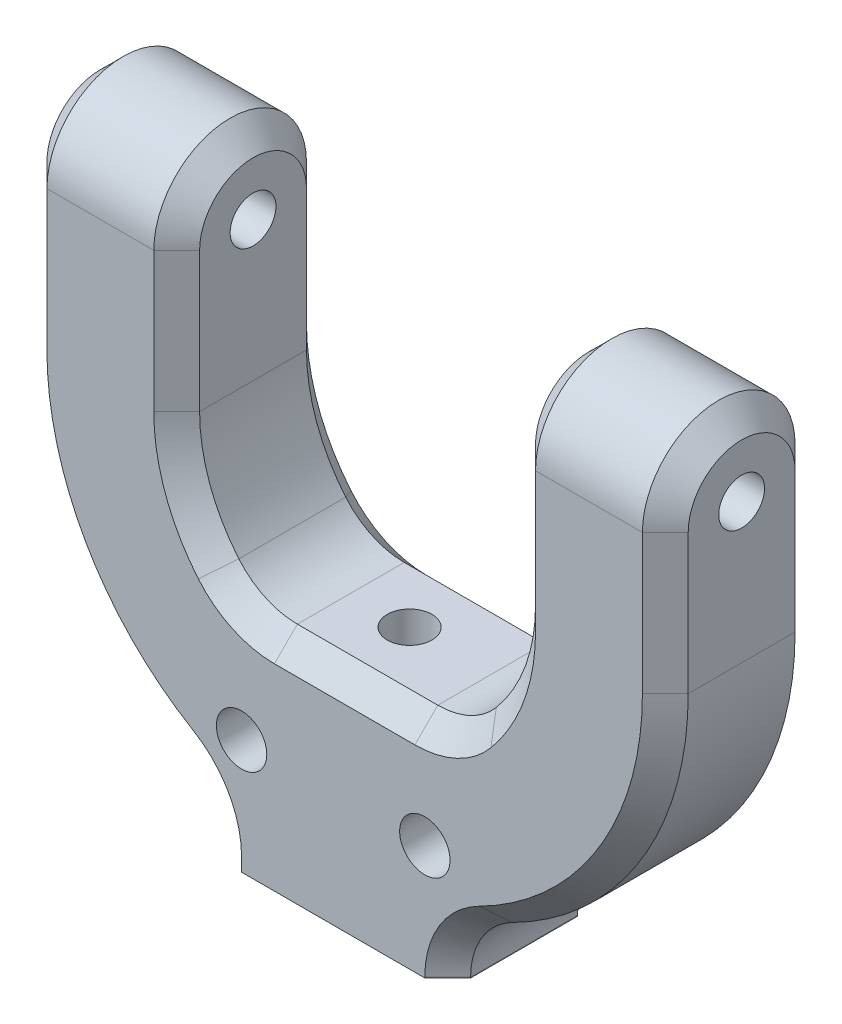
SolidWorks part; units mm, degrees
ref_plane "Plan de face" through (0, 0, 0) normal (0, 0, 1) x (1, 0, 0)
ref_plane "Plan de dessus" through (0, 0, 0) normal (0, 1, 0) x (1, 0, 0)
ref_plane "Plan de droite" through (0, 0, 0) normal (1, 0, 0) x (0, 0, -1)
sketch "Esquisse1" plane through (0, 0, 0) normal (0, 0, 1) x (1, 0, 0)
  line L0 (1.5, -13.5) -> (1.5, 13.5) construction
  line L1 (-20.5, -13.5) -> (-20.5, 14.7927)
  line L2 (23.5, -13.5) -> (23.5, 14.7927)
  line L3 (1.5, -13.5) -> (1.5, 13.5) construction
  line L4 (-40.5, -13.5) -> (-40.5, 14.7927)
  line L5 (43.5, -13.5) -> (43.5, 14.7927)
  line L6 (-38.5, 16.7927) -> (-22.5, 16.7927)
  line L7 (-22.6262, -23.2073) -> (32.5227, -23.2073) construction
  line L8 (15, -60) -> (-15, -60)
  line L9 (15, -60) -> (15, -59.887)
  line L10 (10.6977, -31.2073) -> (-7.6977, -31.2073)
  line L11 (-15, -60) -> (-15, -58.2409)
  line L12 (15, -60) -> (-15, -30) construction
  line L13 (15, -30) -> (-15, -60) construction
  line L14 (1.5, 27.8867) -> (-18.5, 16.3397) construction
  line L15 (-18.5, 16.3397) -> (-18.5, -6.7543) construction
  line L16 (-18.5, -6.7543) -> (1.5, -18.3013) construction
  line L17 (1.5, -18.3013) -> (21.5, -6.7543) construction
  line L18 (21.5, -6.7543) -> (21.5, 16.3397) construction
  line L19 (21.5, 16.3397) -> (1.5, 27.8867) construction
  line L20 (25.5, 16.7927) -> (41.5, 16.7927)
  line L21 (0, -45) -> (0, -55.6719) construction
  arc A0 (-20.5, -13.5) -> (-15.3624, -27.6301) centre (1.5, -13.5) ccw
  arc A1 (18.3624, -27.6301) -> (23.5, -13.5) centre (1.5, -13.5) ccw
  arc A2 (-40.5, -13.5) -> (-19.9038, -49.6369) centre (1.5, -13.5) ccw
  arc A3 (20.4808, -50.9664) -> (43.5, -13.5) centre (1.5, -13.5) ccw
  circle A4 centre (1.5, 4.7927) radius 20 construction
  arc A5 (-15.3624, -27.6301) -> (-7.6977, -31.2073) centre (-7.6977, -21.2073) ccw
  arc A6 (18.3624, -27.6301) -> (10.6977, -31.2073) centre (10.6977, -21.2073) cw
  arc A7 (20.4808, -50.9664) -> (15, -59.887) centre (25, -59.887) ccw
  arc A8 (-19.9038, -49.6369) -> (-15, -58.2409) centre (-25, -58.2409) cw
  arc A9 (43.5, 14.7927) -> (41.5, 16.7927) centre (41.5, 14.7927) ccw
  arc A10 (25.5, 16.7927) -> (23.5, 14.7927) centre (25.5, 14.7927) ccw
  arc A11 (-20.5, 14.7927) -> (-22.5, 16.7927) centre (-22.5, 14.7927) ccw
  arc A12 (-38.5, 16.7927) -> (-40.5, 14.7927) centre (-38.5, 14.7927) ccw
  circle A13 centre (-12, -45) radius 3.3
  circle A14 centre (12, -45) radius 3.3
  point P3 (0, 0)
  point P9 (0, 0)
  point P17 (0, -45)
  point P37 (14.5557, -31.2073)
  point P40 (15, -53.2712)
  dimension "D5" = 40
  dimension "D10" = 10
  dimension "D11" = 2
  dimension "D14" = 6.6
  dimension "D15" = 15
  dimension "D1" = 44
  dimension "D2" = 20
  dimension "D3" = 27
  dimension "D4" = 30
  dimension "D6" = 8
  dimension "D7" = 30
  dimension "D8" = 60
  dimension "D9" = 36
  dimension "D12" = 12
  dimension "D13" = 24
extrude "Boss.-Extru.1" add sketch "Esquisse1" along normal mid plane 30
sketch "Esquisse2" plane through (-20.5, 0, 0) normal (1, 0, 0) x (0, 0, -1)
  line L0 (-15, 16.7927) -> (15, 16.7927) construction
  line L1 (0, -67.2362) -> (0, 4.7927) construction
  line L2 (-10, -67.2362) -> (-10, 4.7927)
  line L3 (10, -67.2362) -> (10, 4.7927)
  circle A0 centre (0, 4.7927) radius 3
  arc A1 (-10, -67.2362) -> (10, -67.2362) centre (0, -67.2362) ccw
  arc A2 (10, 4.7927) -> (-10, 4.7927) centre (0, 4.7927) ccw
  point P6 (0, -31.2217)
  dimension "D1" = 6
  dimension "D2" = 12
  dimension "D3" = 10
extrude "Enlèv. mat.-Extru.1" cut sketch "Esquisse2" against normal through all both and the other way through all flip side to cut
sketch "Esquisse3" plane through (0, -60, 0) normal (0, -1, 0) x (1, 0, 0)
  circle A0 centre (0, 0) radius 2.925
  dimension "D1" = 5.85
extrude "Enlèv. mat.-Extru.2" cut sketch "Esquisse3" against normal blind 30
chamfer "Chanfrein1" distance 3 angle 45 34 edges at (15, -59.9435, -10) (16.4797, -54.6521, -10) (37.2854, -35.4864, -10) (43.5, -4.3537, -10) (15, -59.9435, 10) (43.5, 14.7927, 0) (16.4797, -54.6521, 10) (43.5, -4.3537, 10) (37.2854, -35.4864, 10) (-15, -59.1205, -10) (-16.312, -53.2892, -10) (-34.9895, -34.2971, -10) (-40.5, -4.3537, -10) (-40.5, 14.7927, 0) (-15, -59.1205, 10) (-40.5, -4.3537, 10) (-16.312, -53.2892, 10) (-34.9895, -34.2971, 10) (22.1757, -21.0175, -10) (23.5, -4.3537, -10) (14.9269, -30.269, -10) (23.5, 14.7927, 0) (1.5, -31.2073, -10) (23.5, -4.3537, 10) (-11.9269, -30.269, -10) (22.1757, -21.0175, 10) (-19.1757, -21.0175, -10) (14.9269, -30.269, 10) (-20.5, -4.3537, -10) (1.5, -31.2073, 10) (-20.5, 14.7927, 0) (-11.9269, -30.269, 10) (-20.5, -4.3537, 10) (-19.1757, -21.0175, 10)
